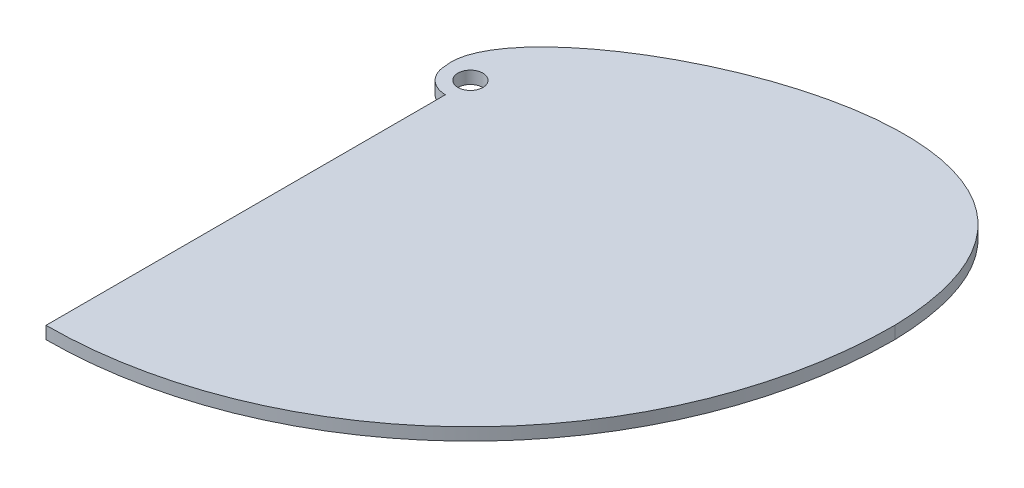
SolidWorks part; units mm, degrees
ref_plane "Front Plane" through (0, 0, 0) normal (0, 0, 1) x (1, 0, 0)
ref_plane "Top Plane" through (0, 0, 0) normal (0, 1, 0) x (1, 0, 0)
ref_plane "Right Plane" through (0, 0, 0) normal (1, 0, 0) x (0, 0, -1)
sketch "Sketch2" plane through (0, 0, 0) normal (0, 1, 0) x (1, 0, 0)
  line L0 (0, -6.35) -> (0, -107.95)
  arc A0 (-6.35, 0) -> (0, -6.35) centre (0, 0) ccw
  arc A1 (0, -107.95) -> (107.95, 0) centre (0, 0) ccw
  circle A2 centre (0, 0) radius 3.175
  spline S0 degree 3 poles (-6.35, 0) (-11.0925, 26.6315) (105.8649, 82.5083) (107.95, 0) knots 0 0 0 0 1 1 1 1
extrude "Boss-Extrude2" add sketch "Sketch2" along normal blind 3.175
